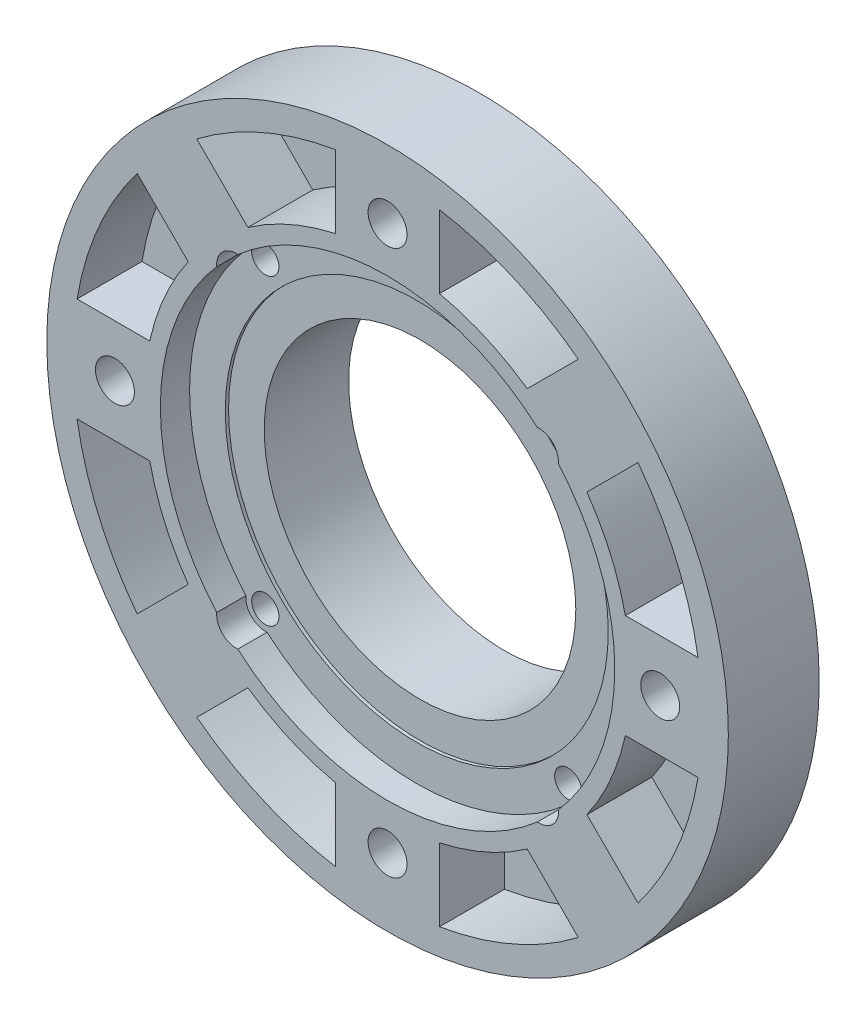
SolidWorks part; units mm, degrees
ref_plane "Face" through (0, 0, 0) normal (0, 0, 1) x (1, 0, 0)
ref_plane "Dessus" through (0, 0, 0) normal (0, 1, 0) x (1, 0, 0)
ref_plane "Droite" through (0, 0, 0) normal (1, 0, 0) x (0, 0, -1)
sketch "Esquisse1" plane through (0, 0, 0) normal (0, 0, 1) x (1, 0, 0)
  circle A0 centre (0, 0) radius 52.5
  circle A1 centre (0, 0) radius 24
  dimension "D1" = 48
  dimension "D2" = 105
extrude "Base-Extrusion" add sketch "Esquisse1" along normal blind 18
sketch "Esquisse2" plane through (0, 0, 18) normal (0, 0, 1) x (1, 0, 0)
  circle A0 centre (0, 0) radius 35
  dimension "D1" = 70
extrude "Enlèv. mat.-Extru.1" cut sketch "Esquisse2" against normal blind 4.5
sketch "Esquisse3" plane through (0, 0, 13.5) normal (0, 0, 1) x (1, 0, 0)
  circle A0 centre (0, 0) radius 29.5
  dimension "D1" = 59
extrude "Enlèv. mat.-Extru.2" cut sketch "Esquisse3" against normal blind 0.5
sketch "Esquisse4" plane through (0, 0, 0) normal (0, 0, -1) x (-1, 0, 0)
  circle A0 centre (0, 0) radius 26
  circle A1 centre (0, 0) radius 52.5 construction
  circle A2 centre (0, 0) radius 52.5
  dimension "D1" = 52
extrude "Enlèv. mat.-Extru.3" cut sketch "Esquisse4" against normal blind 2
sketch "Esquisse5" plane through (0, 0, 2) normal (0, 0, -1) x (-1, 0, 0)
  circle A0 centre (42, 0) radius 3
  circle A1 centre (0, -42) radius 3
  circle A2 centre (-42, 0) radius 3
  circle A3 centre (0, 42) radius 3
  dimension "D2" = 6
  dimension "D3" = 42
  dimension "D1" = 42
extrude "Enlèv. mat.-Extru.4" cut sketch "Esquisse5" against normal through all
sketch "Esquisse6" plane through (0, 0, 2) normal (0, 0, -1) x (-1, 0, 0)
  arc A0 (38.4685, 10.9625) -> (10.9625, 38.4685) centre (0, 0) ccw
  arc A1 (-7.6053, 37.1875) -> (7.6053, 37.1875) centre (0, 42) ccw
  arc A2 (37.1875, 7.6053) -> (37.1875, -7.6053) centre (42, 0) ccw
  arc A3 (7.6053, -37.1875) -> (-7.6053, -37.1875) centre (0, -42) ccw
  arc A4 (-37.1875, -7.6053) -> (-37.1875, 7.6053) centre (-42, 0) ccw
  arc A5 (-10.9625, 38.4685) -> (-38.4685, 10.9625) centre (0, 0) ccw
  arc A6 (-38.4685, -10.9625) -> (-10.9625, -38.4685) centre (0, 0) ccw
  arc A7 (10.9625, -38.4685) -> (38.4685, -10.9625) centre (0, 0) ccw
  arc A8 (38.4685, 10.9625) -> (37.1875, 7.6053) centre (35.5833, 10.1403) cw
  arc A9 (38.4685, -10.9625) -> (37.1875, -7.6053) centre (35.5833, -10.1403) ccw
  arc A10 (7.6053, -37.1875) -> (10.9625, -38.4685) centre (10.1403, -35.5833) ccw
  arc A11 (-10.9625, -38.4685) -> (-7.6053, -37.1875) centre (-10.1403, -35.5833) ccw
  arc A12 (-37.1875, -7.6053) -> (-38.4685, -10.9625) centre (-35.5833, -10.1403) ccw
  arc A13 (-38.4685, 10.9625) -> (-37.1875, 7.6053) centre (-35.5833, 10.1403) ccw
  arc A14 (-7.6053, 37.1875) -> (-10.9625, 38.4685) centre (-10.1403, 35.5833) ccw
  arc A15 (10.9625, 38.4685) -> (7.6053, 37.1875) centre (10.1403, 35.5833) ccw
  circle A16 centre (0, 0) radius 52.5 construction
  circle A17 centre (0, 0) radius 52.5
  point P24 (8.5143, -39.0833)
  point P29 (-39.0833, -8.5143)
  point P34 (-8.5143, 39.0833)
  dimension "D1" = 40
  dimension "D2" = 9
  dimension "D3" = 9
  dimension "D4" = 9
  dimension "D5" = 9
  dimension "D6" = 3
extrude "Enlèv. mat.-Extru.5" cut sketch "Esquisse6" against normal blind 2
sketch "Esquisse7" plane through (0, 0, 4) normal (0, 0, -1) x (-1, 0, 0)
  circle A0 centre (0, 42) radius 5.5
  circle A1 centre (42, 0) radius 5.5
  circle A2 centre (0, -42) radius 5.5
  circle A3 centre (-42, 0) radius 5.5
  dimension "D1" = 11
  dimension "D2" = 11
  dimension "D3" = 11
  dimension "D4" = 11
extrude "Enlèv. mat.-Extru.6" cut sketch "Esquisse7" against normal blind 6
sketch "Esquisse8" plane through (0, 0, 18) normal (0, 0, 1) x (1, 0, 0)
  line L0 (-8, -36.6367) -> (-8, -47.8357)
  line L1 (-8, 47.8357) -> (-8, 36.6367)
  line L2 (8, 47.8357) -> (8, 36.6367)
  line L3 (8, -36.6367) -> (8, -47.8357)
  line L4 (-47.8357, 8) -> (-36.6367, 8)
  line L5 (-47.8357, -8) -> (-36.6367, -8)
  line L6 (36.6367, -8) -> (47.8357, -8)
  line L7 (36.6367, 8) -> (47.8357, 8)
  line L8 (-38.5815, -29.3891) -> (-30.7113, -21.5189)
  line L9 (-29.3891, -38.5815) -> (-21.5189, -30.7113)
  line L10 (21.5189, 30.7113) -> (29.3891, 38.5815)
  line L11 (30.7113, 21.5189) -> (38.5815, 29.3891)
  line L12 (-38.5815, 29.3891) -> (-30.7113, 21.5189)
  line L13 (-29.3891, 38.5815) -> (-21.5189, 30.7113)
  line L14 (30.7113, -21.5189) -> (38.5815, -29.3891)
  line L15 (21.5189, -30.7113) -> (29.3891, -38.5815)
  arc A0 (-8, 47.8357) -> (-29.3891, 38.5815) centre (0, 0) ccw
  arc A1 (-8, 36.6367) -> (-21.5189, 30.7113) centre (0, 0) ccw
  arc A2 (8, -36.6367) -> (21.5189, -30.7113) centre (0, 0) ccw
  arc A3 (8, -47.8357) -> (29.3891, -38.5815) centre (0, 0) ccw
  arc A4 (-47.8357, -8) -> (-38.5815, -29.3891) centre (0, 0) ccw
  arc A5 (-36.6367, -8) -> (-30.7113, -21.5189) centre (0, 0) ccw
  arc A6 (36.6367, 8) -> (30.7113, 21.5189) centre (0, 0) ccw
  arc A7 (47.8357, 8) -> (38.5815, 29.3891) centre (0, 0) ccw
  arc A8 (-29.3891, -38.5815) -> (-8, -47.8357) centre (0, 0) ccw
  arc A9 (-21.5189, -30.7113) -> (-8, -36.6367) centre (0, 0) ccw
  arc A10 (21.5189, 30.7113) -> (8, 36.6367) centre (0, 0) ccw
  arc A11 (29.3891, 38.5815) -> (8, 47.8357) centre (0, 0) ccw
  arc A12 (-38.5815, 29.3891) -> (-47.8357, 8) centre (0, 0) ccw
  arc A13 (-30.7113, 21.5189) -> (-36.6367, 8) centre (0, 0) ccw
  arc A14 (30.7113, -21.5189) -> (36.6367, -8) centre (0, 0) ccw
  arc A15 (38.5815, -29.3891) -> (47.8357, -8) centre (0, 0) ccw
  dimension "D1" = 97
  dimension "D2" = 75
  dimension "D3" = 8
  dimension "D4" = 8
  dimension "D5" = 8
  dimension "D6" = 8
  dimension "D7" = 45
  dimension "D8" = 6.5
  dimension "D9" = 6.5
  dimension "D10" = 45
  dimension "D11" = 6.5
  dimension "D12" = 6.5
extrude "Enlèv. mat.-Extru.7" cut sketch "Esquisse8" against normal blind 10
sketch "Esquisse9" plane through (0, 0, 2) normal (0, 0, -1) x (-1, 0, 0)
  line L0 (23.3345, 23.3345) -> (0, 0) construction
  line L1 (0, 0) -> (42, 0) construction
  line L2 (0, 0) -> (23.3345, 23.3345) construction
  line L3 (-23.3345, 23.3345) -> (0, 0) construction
  circle A0 centre (23.3345, 23.3345) radius 2.1
  circle A1 centre (23.3345, -23.3345) radius 2.1
  circle A2 centre (-23.3345, -23.3345) radius 2.1
  circle A3 centre (-23.3345, 23.3345) radius 2.1
  dimension "D1" = 33
  dimension "D2" = 4.2
  dimension "D4" = 33
  dimension "D3" = 45
extrude "Enlèv. mat.-Extru.8" cut sketch "Esquisse9" against normal through all
sketch "Esquisse10" plane through (0, 0, 18) normal (0, 0, 1) x (1, 0, 0)
  circle A0 centre (23.3345, 23.3345) radius 3
  circle A1 centre (-23.3345, 23.3345) radius 3
  circle A2 centre (-23.3345, -23.3345) radius 3
  circle A3 centre (23.3345, -23.3345) radius 3
  dimension "D1" = 6
  dimension "D2" = 6
  dimension "D3" = 6
  dimension "D4" = 6
extrude "Enlèv. mat.-Extru.9" cut sketch "Esquisse10" against normal up to surface (4.5 mm away)
